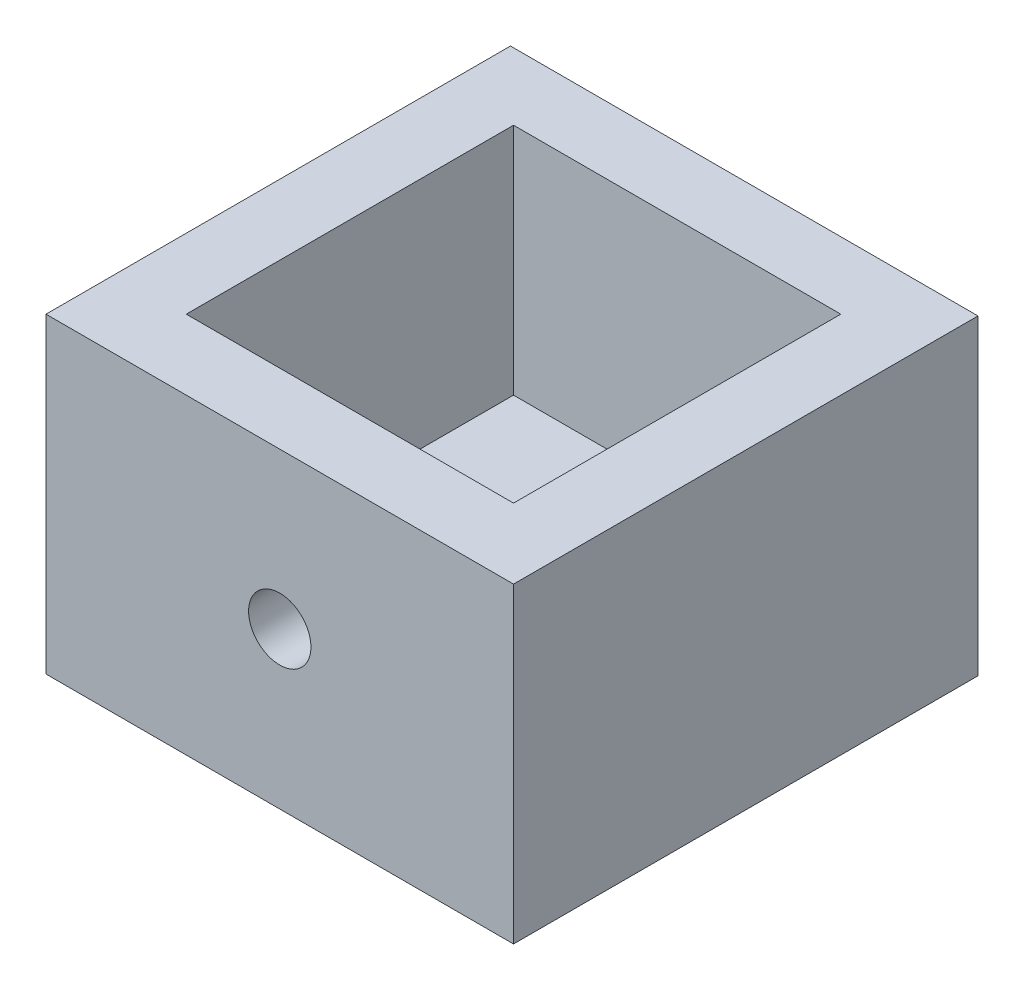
SolidWorks part; units mm, degrees
ref_plane "Front Plane" through (0, 0, 0) normal (0, 0, 1) x (1, 0, 0)
ref_plane "Top Plane" through (0, 0, 0) normal (0, 1, 0) x (1, 0, 0)
ref_plane "Right Plane" through (0, 0, 0) normal (1, 0, 0) x (0, 0, -1)
sketch "Sketch1" plane through (0, 0, 0) normal (0, 0, 1) x (1, 0, 0)
  line L1 (-41.91, -12.7) -> (41.91, -12.7)
  line L2 (-41.91, -12.7) -> (-41.91, 12.7)
  line L3 (-41.91, 12.7) -> (41.91, 12.7)
  line L4 (41.91, -12.7) -> (41.91, 12.7)
  line L5 (-41.91, -12.7) -> (41.91, 12.7) construction
  line L6 (-41.91, 12.7) -> (41.91, -12.7) construction
  point P0 (0, 0)
  dimension "D1" = 83.82
  dimension "D2" = 25.4
extrude "Boss-Extrude1" add sketch "Sketch1" along normal blind 15
sketch "Sketch3" plane through (0, 0, 15) normal (0, 0, 1) x (1, 0, 0)
  line L0 (41.91, -6.86) -> (41.91, -7.62)
  line L1 (-41.91, -6.86) -> (-41.91, -7.62)
  line L2 (-41.4131, -6.6226) -> (-41.415, -6.71)
  line L3 (-40.3041, -6.6534) -> (-40.3058, -6.6983)
  line L4 (24.3041, -6.6534) -> (24.3041, -6.6559)
  line L5 (24.3041, -6.6559) -> (24.3058, -6.6983)
  line L6 (-40.8652, -6.1) -> (-40.8591, -6.1)
  line L7 (-38.8652, -6.1) -> (-38.8591, -6.1)
  line L12 (-39.4131, -6.6226) -> (-39.415, -6.71)
  line L13 (-38.3041, -6.6534) -> (-38.3058, -6.6983)
  line L14 (-37.4131, -6.6226) -> (-37.415, -6.71)
  line L15 (-36.8652, -6.1) -> (-36.8591, -6.1)
  line L16 (-34.8652, -6.1) -> (-34.8591, -6.1)
  line L17 (-32.8652, -6.1) -> (-32.8591, -6.1)
  line L18 (-30.8652, -6.1) -> (-30.8591, -6.1)
  line L19 (-28.8652, -6.1) -> (-28.8591, -6.1)
  line L20 (-26.8654, -6.1) -> (-26.8591, -6.1)
  line L21 (-24.8652, -6.1) -> (-24.8591, -6.1)
  line L22 (24.8591, -6.1) -> (24.8652, -6.1)
  line L23 (26.8591, -6.1) -> (26.8654, -6.1)
  line L24 (28.8591, -6.1) -> (28.8652, -6.1)
  line L25 (30.8591, -6.1) -> (30.8652, -6.1)
  line L26 (32.8591, -6.1) -> (32.8652, -6.1)
  line L27 (34.8591, -6.1) -> (34.8652, -6.1)
  line L28 (36.8591, -6.1) -> (36.8652, -6.1)
  line L29 (38.8591, -6.1) -> (38.8652, -6.1)
  line L30 (40.8591, -6.1) -> (40.8652, -6.1)
  line L347 (22.86, -7.62) -> (41.91, -7.62)
  line L348 (22.86, -7.3726) -> (22.86, -7.62)
  line L349 (22.8652, -6.1) -> (22.86, -7.3726)
  line L350 (23.415, -6.6226) -> (23.4131, -6.6226)
  line L351 (23.415, -6.71) -> (23.415, -6.6226)
  line L352 (24.1562, -6.86) -> (23.565, -6.86)
  line L358 (25.4151, -6.6226) -> (25.4132, -6.6226)
  line L359 (25.4151, -6.7101) -> (25.4151, -6.6226)
  line L360 (26.1563, -6.86) -> (25.5651, -6.8601)
  line L361 (26.3041, -6.6535) -> (26.3041, -6.656)
  line L366 (27.415, -6.6226) -> (27.4131, -6.6226)
  line L367 (27.415, -6.71) -> (27.415, -6.6226)
  line L368 (28.1562, -6.86) -> (27.565, -6.86)
  line L369 (28.3041, -6.6534) -> (28.3041, -6.6559)
  line L374 (29.415, -6.6226) -> (29.4131, -6.6226)
  line L375 (29.415, -6.71) -> (29.415, -6.6226)
  line L376 (30.1562, -6.86) -> (29.565, -6.86)
  line L377 (30.3041, -6.6534) -> (30.3041, -6.6559)
  line L382 (31.415, -6.6226) -> (31.4131, -6.6226)
  line L383 (31.415, -6.71) -> (31.415, -6.6226)
  line L384 (32.1562, -6.86) -> (31.565, -6.86)
  line L385 (32.3041, -6.6534) -> (32.3041, -6.6559)
  line L390 (33.415, -6.6226) -> (33.4131, -6.6226)
  line L391 (33.415, -6.71) -> (33.415, -6.6226)
  line L392 (34.1562, -6.86) -> (33.565, -6.86)
  line L393 (34.3041, -6.6534) -> (34.3041, -6.6559)
  line L398 (35.415, -6.6226) -> (35.4131, -6.6226)
  line L399 (35.415, -6.71) -> (35.415, -6.6226)
  line L400 (36.1562, -6.86) -> (35.565, -6.86)
  line L401 (36.3041, -6.6534) -> (36.3041, -6.6559)
  line L406 (37.415, -6.6226) -> (37.4131, -6.6226)
  line L407 (37.415, -6.71) -> (37.415, -6.6226)
  line L408 (38.1562, -6.86) -> (37.565, -6.86)
  line L409 (38.3041, -6.6534) -> (38.3041, -6.6559)
  line L414 (39.415, -6.6226) -> (39.4131, -6.6226)
  line L415 (39.415, -6.71) -> (39.415, -6.6226)
  line L416 (40.1562, -6.86) -> (39.565, -6.86)
  line L417 (40.3041, -6.6534) -> (40.3041, -6.6559)
  line L422 (41.415, -6.6226) -> (41.4131, -6.6226)
  line L423 (41.415, -6.71) -> (41.415, -6.6226)
  line L424 (41.91, -6.86) -> (41.565, -6.86)
  line L1628 (0, -27.3539) -> (0, 27.3539) construction
  line L1698 (-41.91, -6.86) -> (-41.565, -6.86)
  line L1706 (-40.1562, -6.86) -> (-39.565, -6.86)
  line L1714 (-38.1562, -6.86) -> (-37.565, -6.86)
  line L1721 (-36.3041, -6.6534) -> (-36.3041, -6.6559)
  line L1722 (-36.1562, -6.86) -> (-35.565, -6.86)
  line L1723 (-35.415, -6.71) -> (-35.415, -6.6226)
  line L1724 (-35.415, -6.6226) -> (-35.4131, -6.6226)
  line L1729 (-34.3041, -6.6534) -> (-34.3041, -6.6559)
  line L1730 (-34.1562, -6.86) -> (-33.565, -6.86)
  line L1731 (-33.415, -6.71) -> (-33.415, -6.6226)
  line L1732 (-33.415, -6.6226) -> (-33.4131, -6.6226)
  line L1737 (-32.3041, -6.6534) -> (-32.3041, -6.6559)
  line L1738 (-32.1562, -6.86) -> (-31.565, -6.86)
  line L1739 (-31.415, -6.71) -> (-31.415, -6.6226)
  line L1740 (-31.415, -6.6226) -> (-31.4131, -6.6226)
  line L1745 (-30.3041, -6.6534) -> (-30.3041, -6.6559)
  line L1746 (-30.1562, -6.86) -> (-29.565, -6.86)
  line L1747 (-29.415, -6.71) -> (-29.415, -6.6226)
  line L1748 (-29.415, -6.6226) -> (-29.4131, -6.6226)
  line L1753 (-28.3041, -6.6534) -> (-28.3041, -6.6559)
  line L1754 (-28.1562, -6.86) -> (-27.565, -6.86)
  line L1755 (-27.415, -6.71) -> (-27.415, -6.6226)
  line L1756 (-27.415, -6.6226) -> (-27.4131, -6.6226)
  line L1761 (-26.3041, -6.6535) -> (-26.3041, -6.656)
  line L1762 (-26.1563, -6.86) -> (-25.5651, -6.8601)
  line L1763 (-25.4151, -6.7101) -> (-25.4151, -6.6226)
  line L1764 (-25.4151, -6.6226) -> (-25.4132, -6.6226)
  line L1769 (-24.3041, -6.6534) -> (-24.3041, -6.6549)
  line L1770 (-24.1562, -6.86) -> (-23.565, -6.86)
  line L1771 (-23.415, -6.71) -> (-23.415, -6.6226)
  line L1772 (-23.415, -6.6226) -> (-23.4131, -6.6226)
  line L1773 (-22.8652, -6.1) -> (-22.86, -7.3726)
  line L1774 (-22.86, -7.3726) -> (-22.86, -7.62)
  line L1775 (-22.86, -7.62) -> (-41.91, -7.62)
  arc A210 (23.4131, -6.6226) -> (22.8652, -6.1) centre (22.8591, -6.655) ccw
  arc A211 (23.415, -6.71) -> (23.565, -6.86) centre (23.565, -6.71) ccw
  arc A212 (24.1562, -6.86) -> (24.3058, -6.6983) centre (24.1562, -6.71) ccw
  arc A214 (24.8591, -6.1) -> (24.3041, -6.6534) centre (24.8591, -6.655) ccw
  arc A215 (25.4132, -6.6226) -> (24.8652, -6.1) centre (24.8591, -6.655) ccw
  arc A216 (25.4151, -6.7101) -> (25.5651, -6.8601) centre (25.5651, -6.7101) ccw
  arc A217 (26.1563, -6.86) -> (26.3058, -6.6983) centre (26.1563, -6.71) ccw
  arc A218 (26.3041, -6.656) -> (26.3058, -6.6983) centre (26.8591, -6.655) ccw
  arc A219 (26.8591, -6.1) -> (26.3041, -6.6535) centre (26.8591, -6.655) ccw
  arc A220 (27.4131, -6.6226) -> (26.8654, -6.1) centre (26.8591, -6.655) ccw
  arc A221 (27.415, -6.71) -> (27.565, -6.86) centre (27.565, -6.71) ccw
  arc A222 (28.1562, -6.86) -> (28.3058, -6.6983) centre (28.1562, -6.71) ccw
  arc A223 (28.3041, -6.6559) -> (28.3058, -6.6983) centre (28.8591, -6.655) ccw
  arc A224 (28.8591, -6.1) -> (28.3041, -6.6534) centre (28.8591, -6.655) ccw
  arc A225 (29.4131, -6.6226) -> (28.8652, -6.1) centre (28.8591, -6.655) ccw
  arc A226 (29.415, -6.71) -> (29.565, -6.86) centre (29.565, -6.71) ccw
  arc A227 (30.1562, -6.86) -> (30.3058, -6.6983) centre (30.1562, -6.71) ccw
  arc A228 (30.3041, -6.6559) -> (30.3058, -6.6983) centre (30.8591, -6.655) ccw
  arc A229 (30.8591, -6.1) -> (30.3041, -6.6534) centre (30.8591, -6.655) ccw
  arc A230 (31.4131, -6.6226) -> (30.8652, -6.1) centre (30.8591, -6.655) ccw
  arc A231 (31.415, -6.71) -> (31.565, -6.86) centre (31.565, -6.71) ccw
  arc A232 (32.1562, -6.86) -> (32.3058, -6.6983) centre (32.1562, -6.71) ccw
  arc A233 (32.3041, -6.6559) -> (32.3058, -6.6983) centre (32.8591, -6.655) ccw
  arc A234 (32.8591, -6.1) -> (32.3041, -6.6534) centre (32.8591, -6.655) ccw
  arc A235 (33.4131, -6.6226) -> (32.8652, -6.1) centre (32.8591, -6.655) ccw
  arc A236 (33.415, -6.71) -> (33.565, -6.86) centre (33.565, -6.71) ccw
  arc A237 (34.1562, -6.86) -> (34.3058, -6.6983) centre (34.1562, -6.71) ccw
  arc A238 (34.3041, -6.6559) -> (34.3058, -6.6983) centre (34.8591, -6.655) ccw
  arc A239 (34.8591, -6.1) -> (34.3041, -6.6534) centre (34.8591, -6.655) ccw
  arc A240 (35.4131, -6.6226) -> (34.8652, -6.1) centre (34.8591, -6.655) ccw
  arc A241 (35.415, -6.71) -> (35.565, -6.86) centre (35.565, -6.71) ccw
  arc A242 (36.1562, -6.86) -> (36.3058, -6.6983) centre (36.1562, -6.71) ccw
  arc A243 (36.3041, -6.6559) -> (36.3058, -6.6983) centre (36.8591, -6.655) ccw
  arc A244 (36.8591, -6.1) -> (36.3041, -6.6534) centre (36.8591, -6.655) ccw
  arc A245 (37.4131, -6.6226) -> (36.8652, -6.1) centre (36.8591, -6.655) ccw
  arc A246 (37.415, -6.71) -> (37.565, -6.86) centre (37.565, -6.71) ccw
  arc A247 (38.1562, -6.86) -> (38.3058, -6.6983) centre (38.1562, -6.71) ccw
  arc A248 (38.3041, -6.6559) -> (38.3058, -6.6983) centre (38.8591, -6.655) ccw
  arc A249 (38.8591, -6.1) -> (38.3041, -6.6534) centre (38.8591, -6.655) ccw
  arc A250 (39.4131, -6.6226) -> (38.8652, -6.1) centre (38.8591, -6.655) ccw
  arc A251 (39.415, -6.71) -> (39.565, -6.86) centre (39.565, -6.71) ccw
  arc A252 (40.1562, -6.86) -> (40.3058, -6.6983) centre (40.1562, -6.71) ccw
  arc A253 (40.3041, -6.6559) -> (40.3058, -6.6983) centre (40.8591, -6.655) ccw
  arc A254 (40.8591, -6.1) -> (40.3041, -6.6534) centre (40.8591, -6.655) ccw
  arc A255 (41.4131, -6.6226) -> (40.8652, -6.1) centre (40.8591, -6.655) ccw
  arc A256 (41.415, -6.71) -> (41.565, -6.86) centre (41.565, -6.71) ccw
  arc A1043 (-41.415, -6.71) -> (-41.565, -6.86) centre (-41.565, -6.71) cw
  arc A1044 (-41.4131, -6.6226) -> (-40.8652, -6.1) centre (-40.8591, -6.655) cw
  arc A1045 (-40.8591, -6.1) -> (-40.3041, -6.6534) centre (-40.8591, -6.655) cw
  arc A1047 (-40.1562, -6.86) -> (-40.3058, -6.6983) centre (-40.1562, -6.71) cw
  arc A1048 (-39.415, -6.71) -> (-39.565, -6.86) centre (-39.565, -6.71) cw
  arc A1049 (-39.4131, -6.6226) -> (-38.8652, -6.1) centre (-38.8591, -6.655) cw
  arc A1050 (-38.8591, -6.1) -> (-38.3041, -6.6534) centre (-38.8591, -6.655) cw
  arc A1052 (-38.1562, -6.86) -> (-38.3058, -6.6983) centre (-38.1562, -6.71) cw
  arc A1053 (-37.415, -6.71) -> (-37.565, -6.86) centre (-37.565, -6.71) cw
  arc A1054 (-37.4131, -6.6226) -> (-36.8652, -6.1) centre (-36.8591, -6.655) cw
  arc A1055 (-36.8591, -6.1) -> (-36.3041, -6.6534) centre (-36.8591, -6.655) cw
  arc A1056 (-36.3041, -6.6559) -> (-36.3058, -6.6983) centre (-36.8591, -6.655) cw
  arc A1057 (-36.1562, -6.86) -> (-36.3058, -6.6983) centre (-36.1562, -6.71) cw
  arc A1058 (-35.415, -6.71) -> (-35.565, -6.86) centre (-35.565, -6.71) cw
  arc A1059 (-35.4131, -6.6226) -> (-34.8652, -6.1) centre (-34.8591, -6.655) cw
  arc A1060 (-34.8591, -6.1) -> (-34.3041, -6.6534) centre (-34.8591, -6.655) cw
  arc A1061 (-34.3041, -6.6559) -> (-34.3058, -6.6983) centre (-34.8591, -6.655) cw
  arc A1062 (-34.1562, -6.86) -> (-34.3058, -6.6983) centre (-34.1562, -6.71) cw
  arc A1063 (-33.415, -6.71) -> (-33.565, -6.86) centre (-33.565, -6.71) cw
  arc A1064 (-33.4131, -6.6226) -> (-32.8652, -6.1) centre (-32.8591, -6.655) cw
  arc A1065 (-32.8591, -6.1) -> (-32.3041, -6.6534) centre (-32.8591, -6.655) cw
  arc A1066 (-32.3041, -6.6559) -> (-32.3058, -6.6983) centre (-32.8591, -6.655) cw
  arc A1067 (-32.1562, -6.86) -> (-32.3058, -6.6983) centre (-32.1562, -6.71) cw
  arc A1068 (-31.415, -6.71) -> (-31.565, -6.86) centre (-31.565, -6.71) cw
  arc A1069 (-31.4131, -6.6226) -> (-30.8652, -6.1) centre (-30.8591, -6.655) cw
  arc A1070 (-30.8591, -6.1) -> (-30.3041, -6.6534) centre (-30.8591, -6.655) cw
  arc A1071 (-30.3041, -6.6559) -> (-30.3058, -6.6983) centre (-30.8591, -6.655) cw
  arc A1072 (-30.1562, -6.86) -> (-30.3058, -6.6983) centre (-30.1562, -6.71) cw
  arc A1073 (-29.415, -6.71) -> (-29.565, -6.86) centre (-29.565, -6.71) cw
  arc A1074 (-29.4131, -6.6226) -> (-28.8652, -6.1) centre (-28.8591, -6.655) cw
  arc A1075 (-28.8591, -6.1) -> (-28.3041, -6.6534) centre (-28.8591, -6.655) cw
  arc A1076 (-28.3041, -6.6559) -> (-28.3058, -6.6983) centre (-28.8591, -6.655) cw
  arc A1077 (-28.1562, -6.86) -> (-28.3058, -6.6983) centre (-28.1562, -6.71) cw
  arc A1078 (-27.415, -6.71) -> (-27.565, -6.86) centre (-27.565, -6.71) cw
  arc A1079 (-27.4131, -6.6226) -> (-26.8654, -6.1) centre (-26.8591, -6.655) cw
  arc A1080 (-26.8591, -6.1) -> (-26.3041, -6.6535) centre (-26.8591, -6.655) cw
  arc A1081 (-26.3041, -6.656) -> (-26.3058, -6.6983) centre (-26.8591, -6.655) cw
  arc A1082 (-26.1563, -6.86) -> (-26.3058, -6.6983) centre (-26.1563, -6.71) cw
  arc A1083 (-25.4151, -6.7101) -> (-25.5651, -6.8601) centre (-25.5651, -6.7101) cw
  arc A1084 (-25.4132, -6.6226) -> (-24.8652, -6.1) centre (-24.8591, -6.655) cw
  arc A1085 (-24.8591, -6.1) -> (-24.3041, -6.6534) centre (-24.8591, -6.655) cw
  arc A1086 (-24.3041, -6.6549) -> (-24.3058, -6.6983) centre (-24.8591, -6.655) cw
  arc A1087 (-24.1562, -6.86) -> (-24.3058, -6.6983) centre (-24.1562, -6.71) cw
  arc A1088 (-23.415, -6.71) -> (-23.565, -6.86) centre (-23.565, -6.71) cw
  arc A1089 (-23.4131, -6.6226) -> (-22.8652, -6.1) centre (-22.8591, -6.655) cw
  point P24 (0, 0)
sketch "Sketch4" plane through (0, 0, 15) normal (0, 0, 1) x (1, 0, 0)
  line L1 (-19.05, -12.7) -> (19.05, -12.7)
  line L2 (-19.05, -12.7) -> (-19.05, 12.7)
  line L3 (-19.05, 12.7) -> (19.05, 12.7)
  line L4 (19.05, -12.7) -> (19.05, 12.7)
  line L5 (-19.05, -12.7) -> (19.05, 12.7) construction
  line L6 (-19.05, 12.7) -> (19.05, -12.7) construction
  point P0 (0, 0)
  dimension "D1" = 38.1
extrude "Boss-Extrude2" add sketch "Sketch4" along normal blind 38.1
sketch "Sketch5" plane through (0, 12.7, 0) normal (0, 1, 0) x (1, 0, 0)
  line L1 (-13.335, -47.385) -> (13.335, -47.385)
  line L2 (-13.335, -47.385) -> (-13.335, -20.715)
  line L3 (-13.335, -20.715) -> (13.335, -20.715)
  line L4 (13.335, -47.385) -> (13.335, -20.715)
  line L5 (-13.335, -47.385) -> (13.335, -20.715) construction
  line L6 (-13.335, -20.715) -> (13.335, -47.385) construction
  line L8 (-19.05, -53.1) -> (-19.05, -15) construction
  line L9 (19.05, -53.1) -> (-19.05, -53.1) construction
  point P0 (0, -34.05)
  point P9 (0, -34.05)
  dimension "D1" = 19.05
  dimension "D2" = 26.67
  dimension "D3" = 26.67
  dimension "D4" = 19.05
extrude "Cut-Extrude1" cut sketch "Sketch5" against normal blind 19.05
sketch "Sketch7" plane through (0, -6.35, 0) normal (0, 1, 0) x (1, 0, 0)
  line L0 (-13.335, -47.385) -> (13.335, -47.385) construction
  circle A0 centre (0, -34.05) radius 3.429
  point P0 (0, -34.05)
  dimension "D2" = 6.858
  dimension "D1" = 13.335
extrude "Cut-Extrude2" cut sketch "Sketch7" against normal through all
sketch "Sketch8" plane through (-41.91, 0, 0) normal (-1, 0, 0) x (0, 0, 1)
  line L0 (0, 12.7) -> (0, -12.7) construction
  line L2 (-5.207, 1.3879) -> (-5.207, -1.3879)
  line L5 (0, 2.54) -> (0, -2.54)
  line L7 (-4.3402, 3.2989) -> (-2.667, 4.764)
  line L8 (-2.667, 4.764) -> (-2.667, 2.54)
  line L10 (-2.667, -4.764) -> (-2.667, -2.54)
  line L11 (-4.3402, -3.2989) -> (-2.667, -4.764)
  line L12 (-2.667, 2.54) -> (0, 2.54)
  line L13 (-2.667, -2.54) -> (0, -2.54)
  arc A0 (-4.3402, 3.2989) -> (-5.207, 1.3879) centre (-2.667, 1.3879) ccw
  arc A1 (-5.207, -1.3879) -> (-4.3402, -3.2989) centre (-2.667, -1.3879) ccw
  point P0 (-3.937, -1.0959)
  dimension "D1" = 2.54
  dimension "D2" = 2.54
  dimension "D7" = 2.224
  dimension "D3" = 5.08
  dimension "D4" = 9.5279
  dimension "D5" = 2.54
  dimension "D6" = 2.224
  dimension "D8" = 2.667
  dimension "D9" = 2.54
extrude "Boss-Extrude3" add sketch "Sketch8" against normal blind 83.82
sketch "Sketch10" plane through (41.91, 0, 0) normal (1, 0, 0) x (0, 0, -1)
  line L0 (-15, -12.7) -> (-15, 12.7) construction
  line L1 (-15, 7.62) -> (-8, 7.62)
  line L2 (-15, 7.62) -> (-15, 3.62)
  line L3 (-15, 3.62) -> (-8, 3.62)
  line L4 (-8, 7.62) -> (-8, 3.62)
  line L5 (-15, 12.7) -> (0, 12.7) construction
  dimension "D1" = 7
  dimension "D2" = 4
  dimension "D3" = 5.08
extrude "Cut-Extrude3" cut sketch "Sketch10" against normal through all
extrude "Cut-Extrude4" cut sketch "Sketch3" against normal blind 6
sketch "Sketch13" plane through (0, 0, 53.1) normal (0, 0, 1) x (1, 0, 0)
  line L0 (-19.05, 0) -> (35.3374, 0) construction
  line L1 (-19.05, 12.7) -> (-19.05, -12.7) construction
  line L2 (0, 12.7) -> (0, -16.7732) construction
  line L3 (19.05, 12.7) -> (-19.05, 12.7) construction
  circle A0 centre (0, 0) radius 2.54
  dimension "D1" = 5.08
extrude "Cut-Extrude5" cut sketch "Sketch13" against normal blind 10
ref_plane "Plane3" through (41.91, 3.62, 8) normal (0, 1, 0) x (1, 0, 0)
sketch "Sketch14" plane through (0, 12.7, 0) normal (0, 1, 0) x (1, 0, 0)
  line L0 (41.91, 4.3402) -> (41.91, 5.207) construction
  line L1 (-41.91, -15) -> (41.91, -15)
  line L2 (-41.91, -15) -> (-41.91, 5.207)
  line L3 (-41.91, 5.207) -> (41.91, 5.207)
  line L4 (41.91, -15) -> (41.91, 5.207)
extrude "Cut-Extrude6" cut sketch "Sketch14" against normal blind 50
sketch "Sketch15" plane through (0, -12.7, 0) normal (0, -1, 0) x (1, 0, 0)
  line L0 (19.05, 53.1) -> (19.05, 15) construction
  line L1 (-19.05, 15) -> (19.05, 15)
  line L2 (-19.05, 15) -> (-19.05, 15.25)
  line L3 (-19.05, 15.25) -> (19.05, 15.25)
  line L4 (19.05, 15) -> (19.05, 15.25)
  line L5 (-26.75, 15.25) -> (24.05, 15.25) construction
extrude "Cut-Extrude7" cut sketch "Sketch15" against normal blind 50
